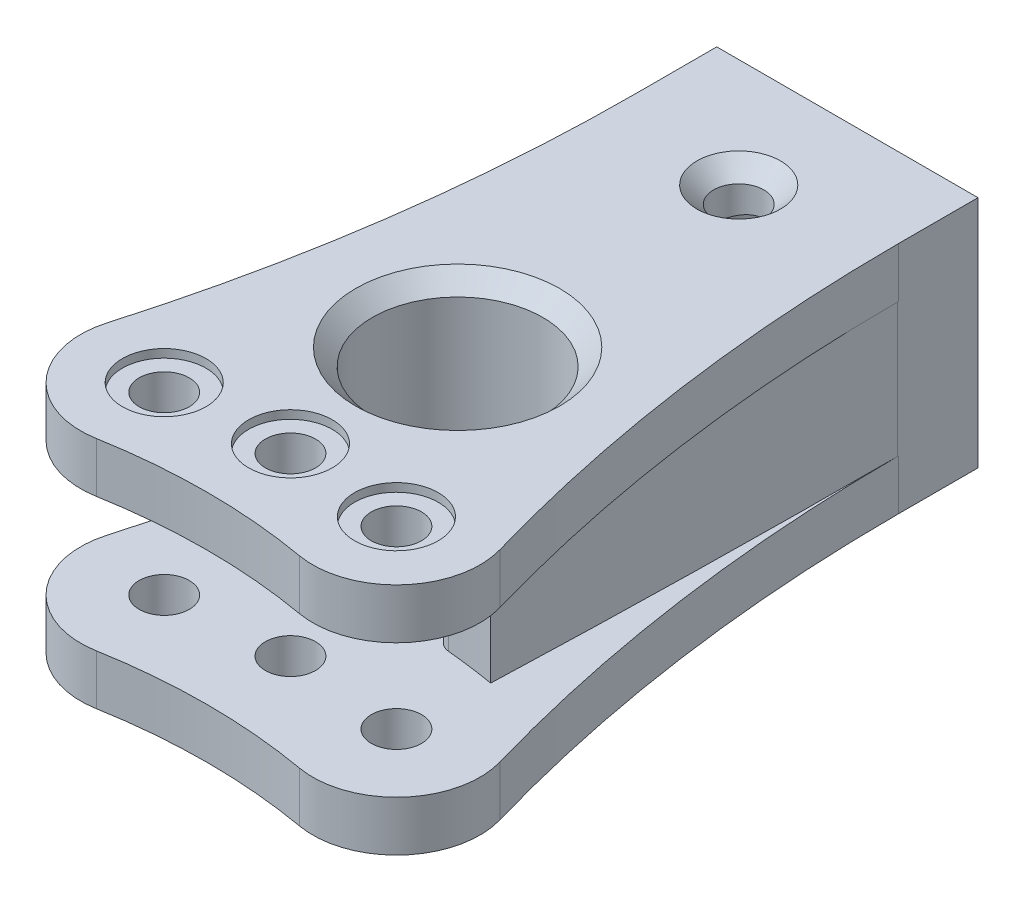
SolidWorks part; units mm, degrees
ref_plane "Front Plane" through (0, 0, 0) normal (0, 0, 1) x (1, 0, 0)
ref_plane "Top Plane" through (0, 0, 0) normal (0, 1, 0) x (1, 0, 0)
ref_plane "Right Plane" through (0, 0, 0) normal (1, 0, 0) x (0, 0, -1)
sketch "Sketch1" plane through (0, 0, 0) normal (0, 1, 0) x (1, 0, 0)
  line L0 (-7.8142, 44.3163) -> (-7.8142, 74.3163)
  line L1 (7.8142, 44.3163) -> (7.8142, 74.3163)
  line L2 (-7.8142, 74.3163) -> (7.8142, 74.3163)
  circle A0 centre (0, 0) radius 40 construction
  circle A1 centre (0, 0) radius 50 construction
  circle A2 centre (0, 50) radius 5.1
  circle A4 centre (0, 0) radius 35
  circle A5 centre (0, 0) radius 45
  circle A6 centre (0, 40) radius 1.5
  circle A7 centre (6.9459, 39.3923) radius 1.5
  circle A8 centre (-6.9459, 39.3923) radius 1.5
  arc A9 (-6.9459, 39.3923) -> (6.9459, 39.3923) centre (0, 0) cw construction
  arc A10 (7.8142, 44.3163) -> (-7.8142, 44.3163) centre (0, 0) ccw
  arc A11 (6.0777, 34.4683) -> (-6.0777, 34.4683) centre (0, 0) ccw
  arc A12 (6.0777, 34.4683) -> (7.8142, 44.3163) centre (6.9459, 39.3923) ccw
  arc A13 (-7.8142, 44.3163) -> (-6.0777, 34.4683) centre (-6.9459, 39.3923) ccw
  point P15 (0, 40)
  dimension "D1" = 80
  dimension "D2" = 100
  dimension "D3" = 10.2
  dimension "D4" = 5
  dimension "D5" = 5
  dimension "D6" = 3
  dimension "D7" = 3
  dimension "D8" = 3
  dimension "D9" = 10
  dimension "D11" = 5
  dimension "D10" = 10
  dimension "D12" = 30
  dimension "D13" = 30
extrude "Boss-Extrude1" add sketch "Sketch1" along normal blind 14 contours A5 L1 L2 L0 A2 | A5 A13 A4 A12 A8 A7 A6
ref_plane "Plane1" through (0, 3, 0) normal (0, -1, 0) x (-1, 0, 0)
sketch "Sketch2" plane through (0, 3, 0) normal (0, -1, 0) x (-1, 0, 0)
  arc A0 (-6.9459, 39.3923) -> (6.9459, 39.3923) centre (0, -40.3056) cw construction
  arc A1 (7.38, 44.3734) -> (-7.38, 44.3734) centre (0, -40.3056) ccw
  arc A2 (6.5118, 34.4112) -> (-6.5118, 34.4112) centre (0, -40.3056) ccw
  arc A3 (6.5118, 34.4112) -> (7.38, 44.3734) centre (6.9459, 39.3923) ccw
  arc A4 (-7.38, 44.3734) -> (-6.5118, 34.4112) centre (-6.9459, 39.3923) ccw
  circle A6 centre (0, 0) radius 35
  point P3 (0, 39.6944)
  dimension "D1" = 80
  dimension "D2" = 5
  dimension "D3" = 70
extrude "Cut-Extrude1" cut sketch "Sketch2" against normal blind 8 contours A6 A2 A3 A1 A4
fillet "Fillet1" radius 100 4 edges at (7.8142, 1.5, -44.3163) (7.8142, 12.5, -44.3163) (-7.8142, 1.5, -44.3163) (-7.8142, 12.5, -44.3163)
sketch "Sketch3" plane through (0, 0, -74.3163) normal (0, 0, -1) x (-1, 0, 0)
  line L0 (7.8142, 14) -> (-7.8142, 14) construction
  circle A0 centre (0, 7) radius 4.5
  dimension "D1" = 9
  dimension "D2" = 7
extrude "Cut-Extrude2" cut sketch "Sketch3" against normal blind 15
chamfer "Chamfer1" distance 1 angle 45 4 edges at (0, 0, -74.3163) (-7.8142, 7, -74.3163) (7.8142, 7, -74.3163) (0, 14, -74.3163)
fillet "Fillet2" radius 670 2 edges at (7.8142, 7, -44.3163) (-7.8142, 7, -44.3163)
chamfer "Chamfer2" distance 1 angle 45 1 edges at (0, 14, -44.9)
chamfer "Chamfer3" distance 1 angle 45 1 edges at (-4.5, 7, -74.3163)
sketch "Sketch4" plane through (0, 14, 0) normal (0, 1, 0) x (1, 0, 0)
  line L3 (7.8142, 73.3163) -> (-7.8142, 73.3163) construction
  line L4 (-6.8142, 74.3163) -> (6.8142, 74.3163) construction
  circle A0 centre (0, 66.8163) radius 1.5
  point P6 (0, 73.3163)
  dimension "D1" = 3
  dimension "D3" = 7.5
  dimension "D2" = 0
extrude "Cut-Extrude3" cut sketch "Sketch4" against normal blind 15
chamfer "Chamfer4" distance 1 angle 45 1 edges at (0, 14, -65.3163)
sketch "Sketch5" plane through (0, 0, 0) normal (0, -1, 0) x (-1, 0, 0)
  circle A0 centre (0, 66.8163) radius 2.5
  dimension "D1" = 5
extrude "Cut-Extrude4" cut sketch "Sketch5" against normal blind 1.5
sketch "Sketch6" plane through (0, 11, 0) normal (0, -1, 0) x (1, 0, 0)
  circle A0 centre (0, 0) radius 45.2
  dimension "D1" = 90.4
extrude "Cut-Extrude6" cut sketch "Sketch6" along normal blind 8
fillet "Fillet3" radius 1 2 edges at (1.6383, 7, -45.1703) (-1.6383, 7, -45.1703)
sketch "Sketch7" plane through (0, 0, 0) normal (0, -1, 0) x (-1, 0, 0)
  circle A0 centre (-6.9459, 39.3923) radius 3
  circle A1 centre (0, 40) radius 3
  circle A2 centre (6.9459, 39.3923) radius 3
  dimension "D1" = 6
  dimension "D2" = 6
  dimension "D3" = 6
extrude "Cut-Extrude7" cut sketch "Sketch7" against normal blind 0.5
sketch "Sketch8" plane through (0, 14, 0) normal (0, 1, 0) x (1, 0, 0)
  circle A0 centre (0, 40) radius 2.5
  circle A1 centre (6.9459, 39.3923) radius 2.5
  circle A2 centre (-6.9459, 39.3923) radius 2.5
  dimension "D1" = 5
  dimension "D2" = 5
  dimension "D3" = 5
extrude "Cut-Extrude8" cut sketch "Sketch8" against normal blind 0.5
sketch "Sketch10" plane through (0, 0, 0) normal (0, -1, 0) x (-1, 0, 0)
  circle A0 centre (0, 50) radius 7
extrude "Boss-Extrude2" add sketch "Sketch10" along normal blind 3
fillet "Fillet4" radius 1.5 2 edges at (0, -3, -57) (0, 0, -57)
sketch "Sketch11" plane through (0, -3, 0) normal (0, -1, 0) x (-1, 0, 0)
  circle A0 centre (0, 50) radius 3
  dimension "D1" = 6
extrude "Cut-Extrude9" cut sketch "Sketch11" against normal blind 3
